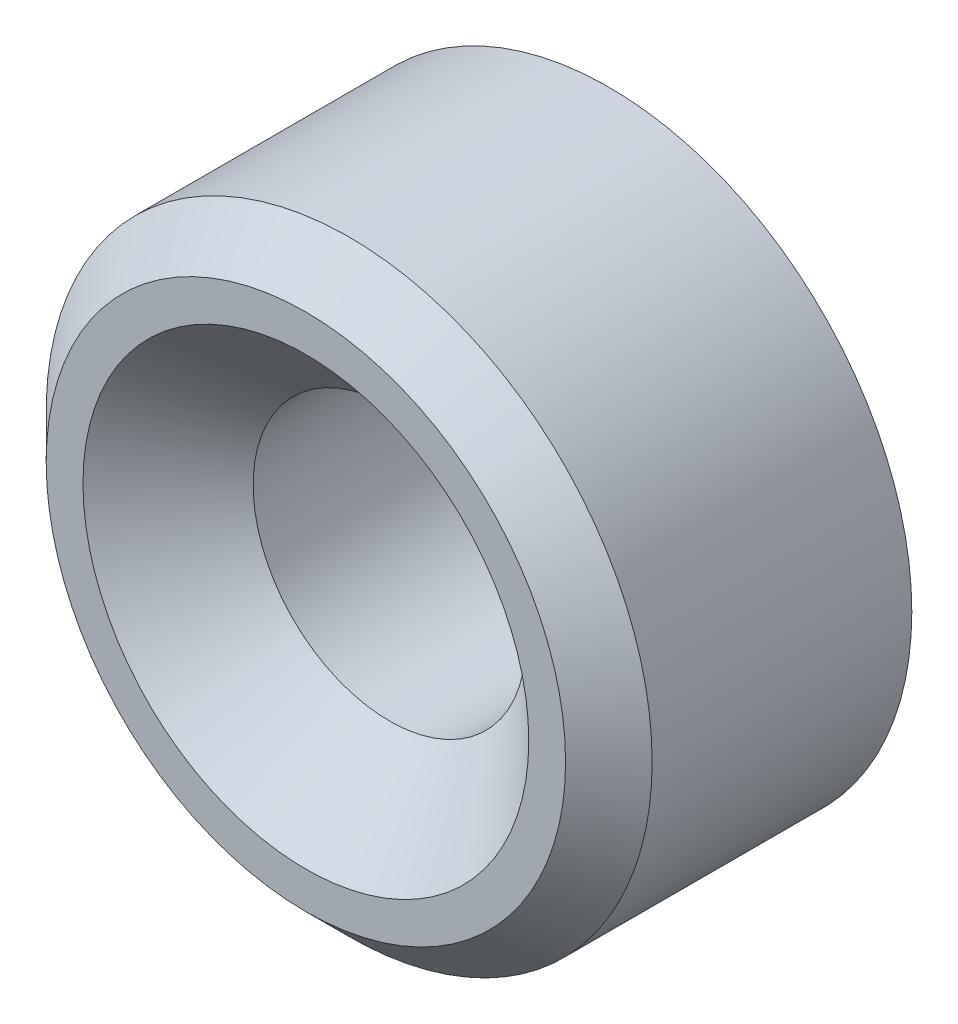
SolidWorks part; units mm, degrees
ref_plane "Plan1" through (0, 0, 0) normal (0, 0, 1) x (1, 0, 0)
ref_plane "Plan2" through (0, 0, 0) normal (0, 1, 0) x (1, 0, 0)
ref_plane "Plan3" through (0, 0, 0) normal (1, 0, 0) x (0, 0, -1)
sketch "Esquisse1" plane through (0, 0, 0) normal (0, 0, 1) x (1, 0, 0)
  circle A0 centre (0, 0) radius 7
  dimension "D1" = 14
extrude "Base-Extrusion" add sketch "Esquisse1" along normal blind 7
chamfer "Chanfrein1" distance 1 angle 45 1 edges at (7, 0, 7)
hole_wizard "Perçage2" positions "Esquisse6" profile "Esquisse5" countersink size "M6" standard "ISO"
sketch "Esquisse6" plane through (0, 0, 7) normal (0, 0, 1) x (1, 0, 0)
  point P0 (0, 0)
sketch "Esquisse5" plane through (0, 0, 7) normal (1, 0, 0) x (0, -1, 0)
  line L0 (0, 0) -> (0, 7)
  line L1 (0, 7) -> (3.15, 7)
  line L2 (3.15, 7) -> (3.15, 1.9314)
  line L3 (3.15, 1.9314) -> (5.15, 0)
  line L5 (5.15, 0) -> (0, 0)
  line L6 (-3.15, 1.9314) -> (-5.15, 0) construction
  line L11 (0, -6.35) -> (0, 107.95) construction
  dimension "Diamètre du perçage jusqu'au prochain" = 6.3
  dimension "Profondeur du perçage jusqu'au prochain" = 7
  dimension "Diamètre du fraisage entrant" = 10.3
  dimension "Angle du fraisage entrant" = 92
